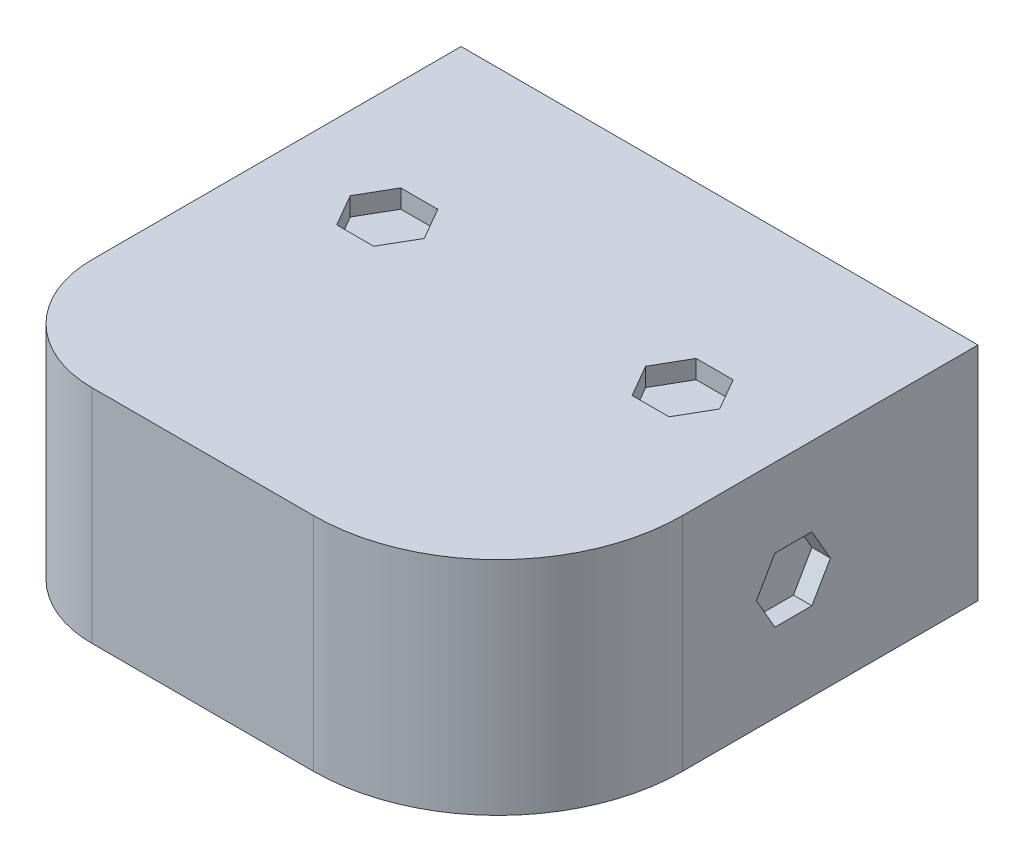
SolidWorks part; units mm, degrees
ref_plane "Front Plane" through (0, 0, 0) normal (0, 0, 1) x (1, 0, 0)
ref_plane "Top Plane" through (0, 0, 0) normal (0, 1, 0) x (1, 0, 0)
ref_plane "Right Plane" through (0, 0, 0) normal (1, 0, 0) x (0, 0, -1)
sketch "Sketch1" plane through (0, 0, 0) normal (0, 1, 0) x (1, 0, 0)
  line L1 (19.05, 0) -> (57.15, 0)
  line L2 (0, 19.05) -> (0, 82.55)
  line L3 (0, 82.55) -> (88.9, 82.55)
  line L4 (88.9, 31.75) -> (88.9, 82.55)
  arc A0 (0, 19.05) -> (19.05, 0) centre (19.05, 19.05) ccw
  arc A1 (88.9, 31.75) -> (57.15, 0) centre (57.15, 31.75) cw
  point P7 (0, 0)
  point P10 (88.9, 0)
  dimension "D3" = 19.05
  dimension "D4" = 31.75
  dimension "D1" = 82.55
  dimension "D2" = 88.9
extrude "Boss-Extrude1" add sketch "Sketch1" along normal blind 38.1
sketch "Sketch2" plane through (0, 0, -82.55) normal (0, 0, -1) x (-1, 0, 0)
  line L0 (-19.05, 18.1689) -> (-69.85, 17.1091) construction
  line L1 (-25.4145, 18.1689) -> (-22.2322, 12.6571)
  line L2 (-22.2322, 12.6571) -> (-15.8678, 12.6571)
  line L3 (-15.8678, 12.6571) -> (-12.6855, 18.1689)
  line L4 (-12.6855, 18.1689) -> (-15.8678, 23.6807)
  line L5 (-15.8678, 23.6807) -> (-22.2322, 23.6807)
  line L6 (-22.2322, 23.6807) -> (-25.4145, 18.1689)
  line L9 (-88.9, 38.1) -> (0, 38.1) construction
  line L10 (-88.9, 38.1) -> (0, 38.1) construction
  line L11 (-44.45, 38.1) -> (-44.45, 17.639) construction
  line L12 (-73.0322, 11.5973) -> (-66.6678, 11.5973)
  line L13 (-76.2145, 17.1091) -> (-73.0322, 11.5973)
  line L14 (-66.6678, 11.5973) -> (-63.4855, 17.1091)
  line L15 (-73.0322, 22.6209) -> (-76.2145, 17.1091)
  line L16 (-66.6678, 22.6209) -> (-73.0322, 22.6209)
  line L17 (-63.4855, 17.1091) -> (-66.6678, 22.6209)
  circle A0 centre (-19.05, 18.1689) radius 5.5118 construction
  circle A1 centre (-69.85, 17.1091) radius 5.5118 construction
  dimension "D1" = 11.0236
  dimension "D2" = 11.0236
  dimension "D3" = 50.8
extrude "Cut-Extrude1" cut sketch "Sketch2" against normal blind 3.175
sketch "Sketch3" plane through (0, 38.1, 0) normal (0, 1, 0) x (1, 0, 0)
  line L0 (19.05, 50.8) -> (69.85, 50.8) construction
  line L1 (63.4855, 50.8) -> (66.6678, 45.2882)
  line L2 (76.2145, 50.8) -> (73.0322, 56.3118)
  line L3 (73.0322, 56.3118) -> (66.6678, 56.3118)
  line L4 (66.6678, 56.3118) -> (63.4855, 50.8)
  line L5 (66.6678, 45.2882) -> (73.0322, 45.2882)
  line L6 (73.0322, 45.2882) -> (76.2145, 50.8)
  line L9 (15.8678, 45.2882) -> (22.2322, 45.2882)
  line L10 (12.6855, 50.8) -> (15.8678, 45.2882)
  line L11 (22.2322, 45.2882) -> (25.4145, 50.8)
  line L12 (15.8678, 56.3118) -> (12.6855, 50.8)
  line L13 (22.2322, 56.3118) -> (15.8678, 56.3118)
  line L14 (25.4145, 50.8) -> (22.2322, 56.3118)
  line L15 (44.45, 82.55) -> (44.45, 50.8) construction
  line L17 (88.9, 82.55) -> (0, 82.55) construction
  circle A0 centre (69.85, 50.8) radius 5.5118 construction
  circle A1 centre (19.05, 50.8) radius 5.5118 construction
  dimension "D1" = 50.8
  dimension "D2" = 31.75
  dimension "D3" = 11.0236
extrude "Cut-Extrude2" cut sketch "Sketch3" against normal blind 3.175
sketch "Sketch4" plane through (88.9, 0, 0) normal (1, 0, 0) x (0, 0, -1)
  line L0 (47.6178, 13.5382) -> (53.9822, 13.5382)
  line L1 (44.4355, 19.05) -> (47.6178, 13.5382)
  line L2 (53.9822, 13.5382) -> (57.1645, 19.05)
  line L3 (47.6178, 24.5618) -> (44.4355, 19.05)
  line L4 (53.9822, 24.5618) -> (47.6178, 24.5618)
  line L5 (57.1645, 19.05) -> (53.9822, 24.5618)
  line L6 (82.55, 19.05) -> (50.8, 19.05) construction
  line L7 (82.55, 38.1) -> (82.55, 0) construction
  circle A0 centre (50.8, 19.05) radius 5.5118 construction
  dimension "D1" = 11.0236
  dimension "D2" = 6.3645
  dimension "D3" = 31.75
extrude "Cut-Extrude3" cut sketch "Sketch4" against normal blind 3.175
